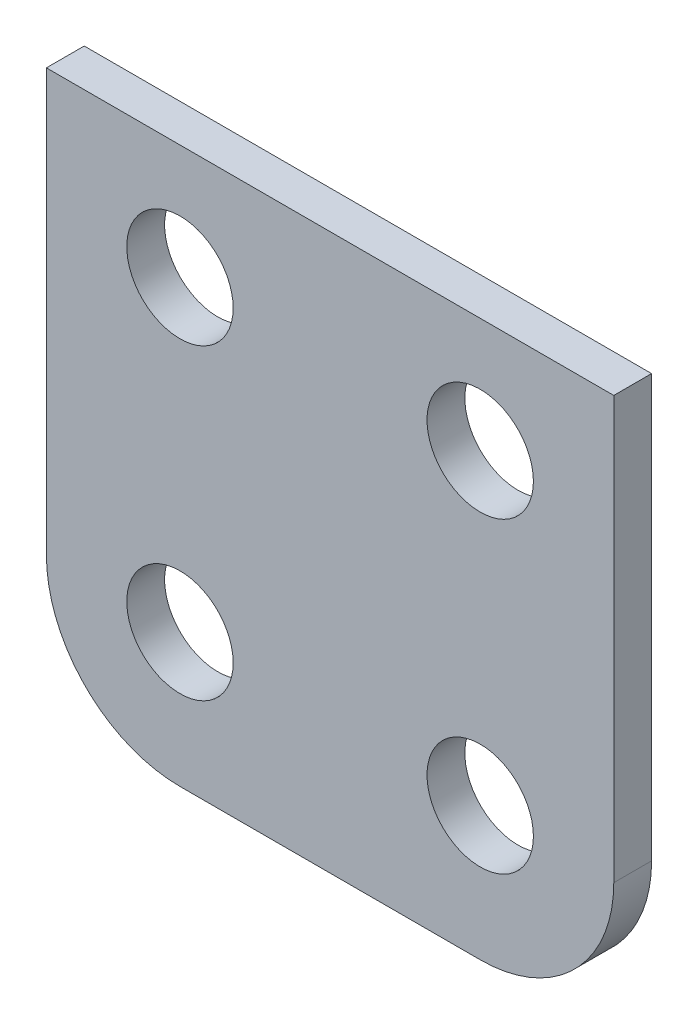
SolidWorks part; units mm, degrees
ref_plane "Ebene vorne" through (0, 0, 0) normal (0, 0, 1) x (1, 0, 0)
ref_plane "Ebene oben" through (0, 0, 0) normal (0, 1, 0) x (1, 0, 0)
ref_plane "Ebene rechts" through (0, 0, 0) normal (1, 0, 0) x (0, 0, -1)
sketch "Skizze1" plane through (0, 0, 0) normal (0, 0, 1) x (1, 0, 0)
  line L0 (5.65, 0) -> (18.35, 0)
  line L1 (24, 5.65) -> (24, 23.5)
  line L2 (24, 23.5) -> (0, 23.5)
  line L3 (0, 23.5) -> (0, 5.65)
  arc A0 (24, 5.65) -> (18.35, 0) centre (18.35, 5.65) cw
  arc A1 (5.65, 0) -> (0, 5.65) centre (5.65, 5.65) cw
extrude "Linear austragen1" add sketch "Skizze1" along normal blind 1.6
hole_wizard "Ø4.5 (4.5) Durchmesser Bohrung1" positions "3D-Skizze1" profile "Skizze3" hole size "Ø4.5" standard "Ansi Metrisch"
sketch3d "3D-Skizze1"
  line L0 (24, 23.5, 1.6) -> (0, 23.5, 1.6) construction
  line L1 (0, 23.5, 1.6) -> (0, 5.65, 1.6) construction
  point P0 (5.65, 5.65, 1.6)
  point P2 (18.35, 5.65, 1.6)
  point P4 (18.35, 18.65, 1.6)
  point P6 (5.65, 18.65, 1.6)
  dimension "D1" = 17.85
  dimension "D2" = 17.85
  dimension "D3" = 4.85
  dimension "D4" = 4.85
  dimension "D5" = 5.65
  dimension "D6" = 5.65
  dimension "D7" = 18.35
  dimension "D8" = 18.35
sketch "Skizze3" plane through (5.65, 5.65, 1.6) normal (1, 0, 0) x (0, -1, 0)
  line L0 (0, 0) -> (0, 1.6)
  line L1 (0, 1.6) -> (2.25, 1.6)
  line L2 (2.25, 1.6) -> (2.25, 0)
  line L5 (2.25, 0) -> (0, 0)
  line L11 (0, -6.35) -> (0, 107.95) construction
  dimension "Bohrerdurchmesser" = 4.5
  dimension "Bohrungstiefe" = 1.6
